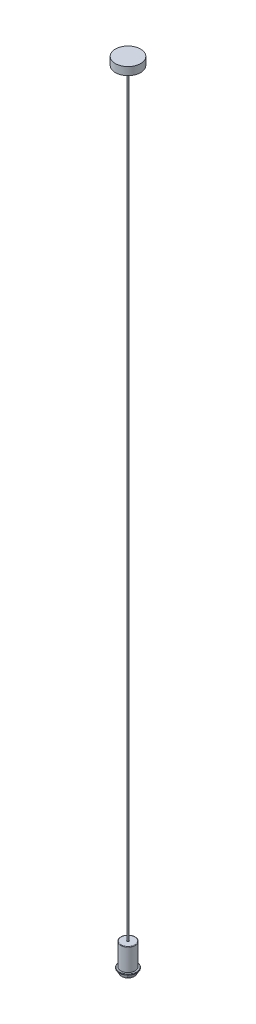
SolidWorks part; units mm, degrees
ref_plane "Alzado" through (0, 0, 0) normal (0, 0, 1) x (1, 0, 0)
ref_plane "Planta" through (0, 0, 0) normal (0, 1, 0) x (1, 0, 0)
ref_plane "Vista lateral" through (0, 0, 0) normal (1, 0, 0) x (0, 0, -1)
sketch "Croquis1" plane through (0, 0, 0) normal (0, 1, 0) x (1, 0, 0)
  circle A0 centre (0, 0) radius 23
extrude "Saliente-Extruir1" add sketch "Croquis1" along normal blind 71
fillet "Redondeo1" radius 1.5 1 edges at (0, 71, 23)
sketch "Croquis2" plane through (0, 71, 0) normal (0, 1, 0) x (1, 0, 0)
  circle A0 centre (0, 0) radius 3.5
  dimension "D1" = 7
extrude "Cortar-Extruir1" cut sketch "Croquis2" against normal blind 1.5
sketch "Croquis3" plane through (0, 69.5, 0) normal (0, 1, 0) x (1, 0, 0)
  circle A0 centre (0, 0) radius 2.5
  dimension "D1" = 5
extrude "Cortar-Extruir2" cut sketch "Croquis3" against normal blind 3
sketch "Croquis4" plane through (0, 66.5, 0) normal (0, 1, 0) x (1, 0, 0)
  circle A0 centre (0, 0) radius 2
  dimension "D1" = 4
extrude "Saliente-Extruir2" add sketch "Croquis4" along normal blind 2400
sketch "Croquis5" plane through (0, 2466.5, 0) normal (0, 1, 0) x (1, 0, 0)
  circle A0 centre (0, 0) radius 6.5
  dimension "D1" = 13
extrude "Saliente-Extruir3" add sketch "Croquis5" along normal blind 10
sketch "Croquis6" plane through (0, 2476.5, 0) normal (0, 1, 0) x (1, 0, 0)
  circle A0 centre (0, 0) radius 40
  dimension "D1" = 80
extrude "Saliente-Extruir4" add sketch "Croquis6" along normal blind 25
sketch "Croquis7" plane through (0, 0, 0) normal (0, -1, 0) x (1, 0, 0)
  circle A0 centre (0, 0) radius 22.5
  dimension "D1" = 45
extrude "Cortar-Extruir3" cut sketch "Croquis7" against normal blind 35
sketch "Croquis8" plane through (0, 35, 0) normal (0, -1, 0) x (1, 0, 0)
  circle A0 centre (0, 0) radius 20
  dimension "D1" = 40
extrude "Saliente-Extruir5" add sketch "Croquis8" along normal blind 52
ref_plane "Plano1" through (0, -0.8, 0) normal (0, -1, 0) x (-1, 0, 0)
sketch "Croquis9" plane through (0, -0.8, 0) normal (0, -1, 0) x (-1, 0, 0)
  circle A0 centre (0, 0) radius 28
  dimension "D1" = 56
extrude "Saliente-Extruir6" add sketch "Croquis9" along normal blind 3.5 separate body
fillet "Redondeo2" radius 1 2 edges at (0, -0.8, -28) (0, -4.3, -28)
sketch "Croquis10" plane through (0, -4.3, 0) normal (0, -1, 0) x (1, 0, 0)
  circle A0 centre (0, 0) radius 20
  circle A1 centre (0, 0) radius 23
  dimension "D1" = 40
  dimension "D2" = 3
extrude "Saliente-Extruir7" add sketch "Croquis10" along normal blind 8
sketch "Croquis11" plane through (0, -4.3, 0) normal (0, -1, 0) x (1, 0, 0)
  circle A1 centre (0, 0) radius 20
  circle A2 centre (0, 0) radius 20
  dimension "D1" = 0
extrude "Cortar-Extruir4" cut sketch "Croquis11" against normal up to next (3.5 mm away)
sketch "Croquis12" plane through (0, -17, 0) normal (0, -1, 0) x (1, 0, 0)
  circle A0 centre (0, 0) radius 19
extrude "Cortar-Extruir5" cut sketch "Croquis12" against normal blind 58
